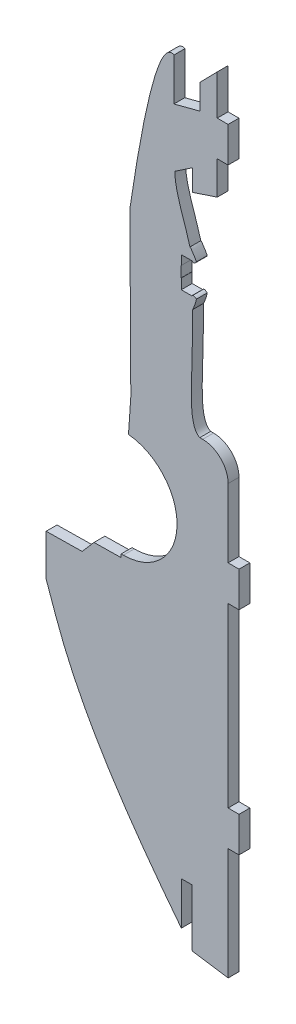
SolidWorks part; units mm, degrees
ref_plane "Alzado" through (0, 0, 0) normal (0, 0, 1) x (1, 0, 0)
ref_plane "Planta" through (0, 0, 0) normal (0, 1, 0) x (1, 0, 0)
ref_plane "Vista lateral" through (0, 0, 0) normal (1, 0, 0) x (0, 0, -1)
sketch "Croquis2" plane through (0, 0, 0) normal (0, 0, 1) x (1, 0, 0)
sketch_block_instance "F1 CAR CUT corte-1"
sketch_block "Bloque1"
extrude "Saliente-Extruir1" add sketch "Croquis2" along normal blind 3
delete or keep bodies "Sólido-Eliminar/Conservar 2" type delete bodies bodies 110 106 102 111 101 103 112 108 104 113 105 114
delete or keep bodies "Sólido-Eliminar/Conservar 3" type delete bodies bodies 107
